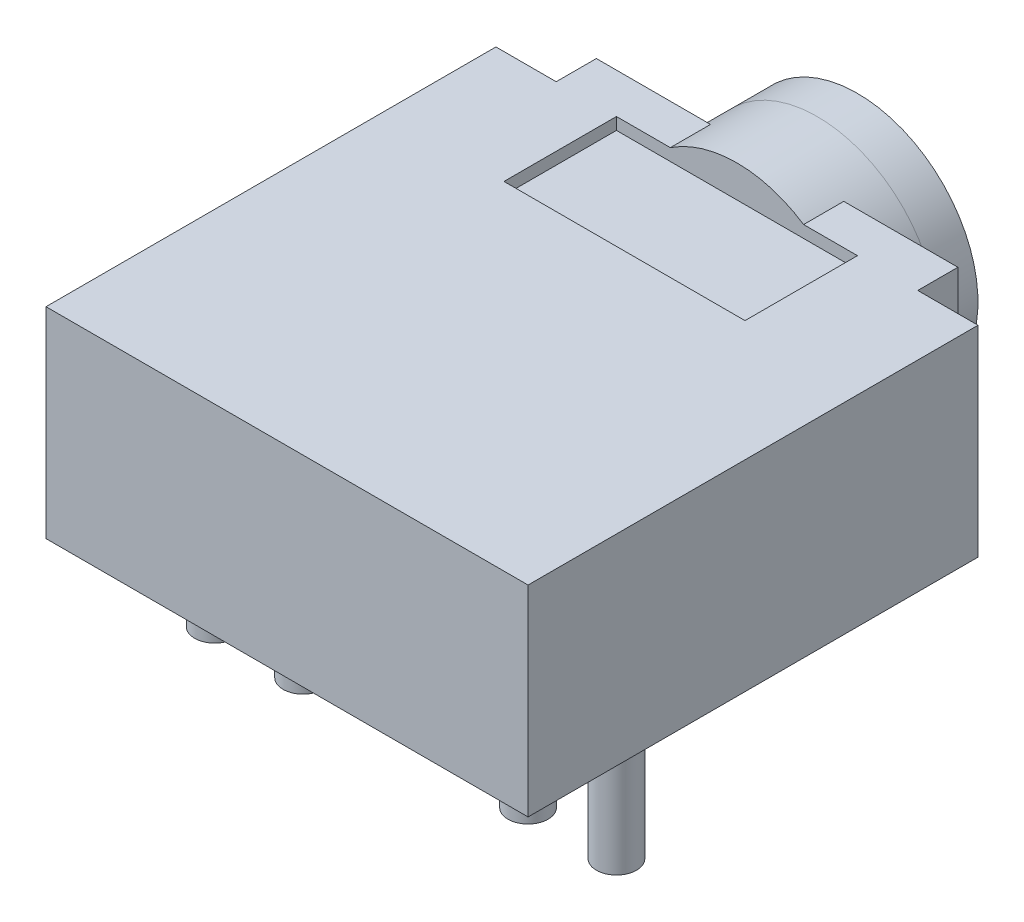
SolidWorks part; units mm, degrees
ref_plane "Plan de face" through (0, 0, 0) normal (0, 0, 1) x (1, 0, 0)
ref_plane "Plan de dessus" through (0, 0, 0) normal (0, 1, 0) x (1, 0, 0)
ref_plane "Plan de droite" through (0, 0, 0) normal (1, 0, 0) x (0, 0, -1)
sketch "Esquisse2" plane through (0, 0, 0) normal (0, 1, 0) x (1, 0, 0)
  line L0 (-26.5307, 0) -> (15.76, 0) construction
  line L1 (0, -13.1531) -> (0, 26.4246) construction
  line L2 (-6, -1.6309) -> (-6, 14.6257) construction
  line L3 (-14.1936, 11.2) -> (2.8301, 11.2) construction
  line L4 (-4.5, 14.6257) -> (-4.5, 9.6009) construction
  line L5 (-14.1936, 12.2) -> (2.8301, 12.2) construction
  line L6 (4.5, 12.2) -> (-4.5, 12.2)
  line L7 (-4.5, 12.2) -> (-4.5, 11.2)
  line L8 (-4.5, 11.2) -> (-6, 11.2)
  line L9 (-6, 11.2) -> (-6, 0)
  line L10 (-6, 0) -> (6, 0)
  line L11 (6, 11.2) -> (6, 0)
  line L12 (4.5, 12.2) -> (4.5, 11.2)
  line L13 (4.5, 11.2) -> (6, 11.2)
  point P19 (0, 0)
  point P22 (0, 12.2)
  dimension "D1" = 6
  dimension "D2" = 11.2
  dimension "D3" = 1
  dimension "D4" = 1.5
extrude "Extrusion1" add sketch "Esquisse2" along normal blind 5
sketch "Esquisse3" plane through (0, 5, 0) normal (0, 1, 0) x (-1, 0, 0)
  line L0 (6.9861, -11.2) -> (-6.9563, -11.2) construction
  line L1 (4.5, -12.6099) -> (4.5, -6.1967) construction
  line L2 (3, -12.6099) -> (3, -6.1967) construction
  line L3 (-4.5, -12.7587) -> (-4.5, -6.1967) construction
  line L4 (-3, -12.7587) -> (-3, -6.1967) construction
  line L5 (4.2036, -8.4) -> (-4.2036, -8.4) construction
  line L7 (3, -11.2) -> (-3, -11.2)
  line L8 (3, -11.2) -> (3, -8.4)
  line L9 (3, -8.4) -> (-3, -8.4)
  line L10 (-3, -11.2) -> (-3, -8.4)
  dimension "D1" = 1.5
  dimension "D2" = 1.5
  dimension "D3" = 2.8
extrude "Enlèv. mat.-Extru.1" cut sketch "Esquisse3" against normal blind 0.3
sketch "Esquisse5" plane through (0, 0, -11.2) normal (0, 0, -1) x (-1, 0, 0)
  line L0 (0, -2.3125) -> (0, 9.7065) construction
  line L1 (6.6039, 5) -> (-7.6299, 5) construction
  line L2 (-7.6299, 2.5) -> (6.6039, 2.5) construction
  circle A0 centre (0, 2.5) radius 3
  dimension "D1" = 2.5
extrude "Extrusion2" add sketch "Esquisse5" along normal blind 2
sketch "Esquisse6" plane through (0, 0, -13.2) normal (0, 0, -1) x (-1, 0, 0)
  line L0 (0, -1.4075) -> (0, 7.595) construction
  line L1 (-6.4408, 5) -> (6.7349, 5) construction
  line L2 (-6.4408, 2.5) -> (6.9724, 2.5) construction
  circle A0 centre (0, 2.5) radius 2.999
  dimension "D1" = 2.5
extrude "Extrusion3" add sketch "Esquisse6" along normal blind 1
sketch "Esquisse7" plane through (0, 0, -14.2) normal (0, 0, -1) x (-1, 0, 0)
  line L0 (0, -1.8493) -> (0, 5.7634) construction
  line L1 (-6.5438, 2.5) -> (6.2723, 2.5) construction
  line L2 (6.3359, 5) -> (-6.5438, 5) construction
  circle A0 centre (0, 2.5) radius 1.75
  dimension "D1" = 2.5
extrude "Enlèv. mat.-Extru.2" cut sketch "Esquisse7" against normal blind 10
sketch "Esquisse8" plane through (0, 0, 0) normal (0, -1, 0) x (1, 0, 0)
  line L0 (-8.1314, -11.2) -> (9.1878, -11.2) construction
  line L1 (-8.1314, -3.2) -> (9.1878, -3.2) construction
  line L2 (0, 0.7543) -> (0, -14.8677) construction
  line L3 (-5, 1.3556) -> (-5, -4.3085) construction
  line L4 (-2.8, 2.4337) -> (-2.8, -4.3085) construction
  line L5 (-6, 2.4337) -> (-6, -12.5815) construction
  line L6 (-6.6765, -8.4) -> (3.5764, -8.4) construction
  circle A0 centre (-5, -3.2) radius 0.5
  circle A1 centre (-2.8, -3.2) radius 0.5
  circle A2 centre (0, -8.4) radius 0.5
  circle A3 centre (5, -3.2) radius 0.5
  circle A4 centre (2.8, -3.2) radius 0.5
  dimension "D1" = 8
  dimension "D2" = 5.2
  dimension "D3" = 1
  dimension "D4" = 3.2
extrude "Extrusion4" add sketch "Esquisse8" along normal blind 3
